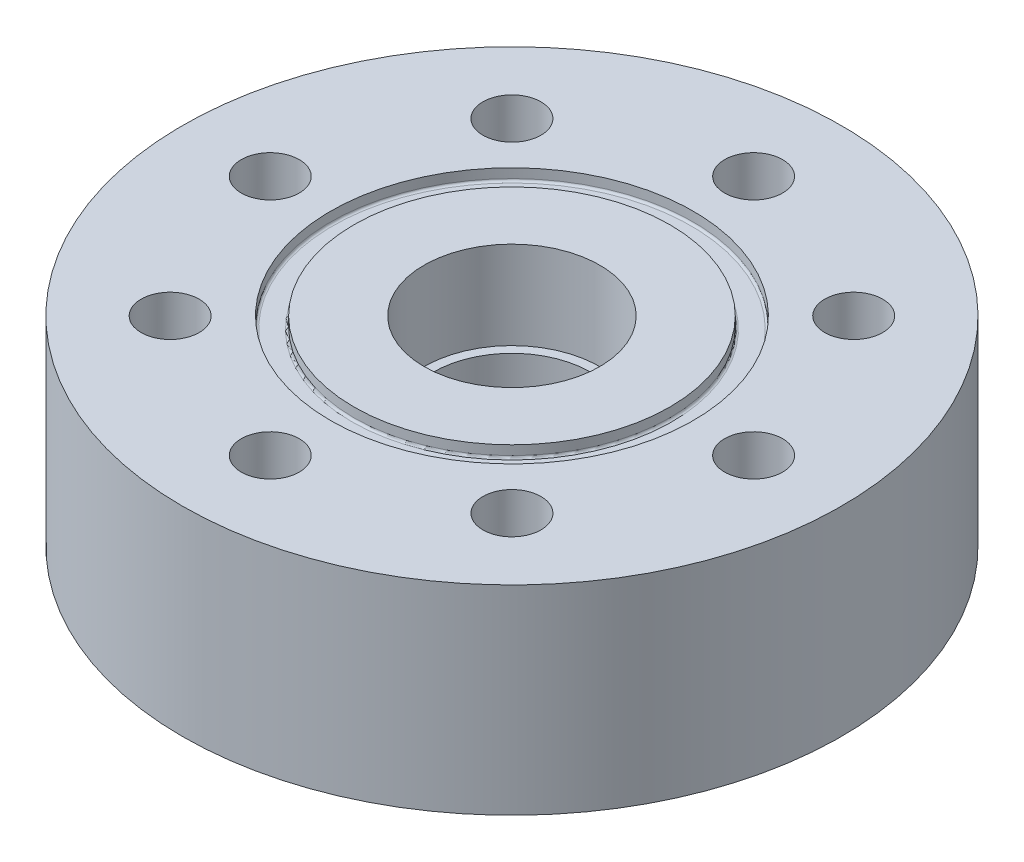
SolidWorks part; units mm, degrees
ref_plane "Front Plane" through (0, 0, 0) normal (0, 0, 1) x (1, 0, 0)
ref_plane "Top Plane" through (0, 0, 0) normal (0, 1, 0) x (1, 0, 0)
ref_plane "Right Plane" through (0, 0, 0) normal (1, 0, 0) x (0, 0, -1)
sketch "Sketch2" plane through (0, 0, 0) normal (0, 1, 0) x (1, 0, 0)
  circle A0 centre (0, 0) radius 37.5
  dimension "D1" = 75
extrude "Outer Cylinder" add sketch "Sketch2" along normal blind 22.7
sketch "Sketch3" plane through (0, 0, 0) normal (0, -1, 0) x (1, 0, 0)
  circle A0 centre (0, 0) radius 8.93
  dimension "D1" = 17.86
extrude "NPT Hole" cut sketch "Sketch3" against normal blind 12.7
sketch "Sketch4" plane through (0, 0, 0) normal (0, -1, 0) x (1, 0, 0)
  circle A0 centre (-27.5, 0) radius 3.3
  circle A1 centre (-19.4454, 19.4454) radius 3.3
  circle A2 centre (0, 27.5) radius 3.3
  circle A3 centre (19.4454, 19.4454) radius 3.3
  circle A4 centre (27.5, 0) radius 3.3
  circle A5 centre (19.4454, -19.4454) radius 3.3
  circle A6 centre (0, -27.5) radius 3.3
  circle A7 centre (-19.4454, -19.4454) radius 3.3
  point P19 (0, 0)
  dimension "D1" = 6.6
  dimension "D2" = 27.5
  dimension "D3" = 8
extrude "Bolt Holes" cut sketch "Sketch4" against normal through all
sketch "Sketch5" plane through (0, 22.7, 0) normal (0, 1, 0) x (1, 0, 0)
  circle A0 centre (0, 0) radius 17.9705
  circle A1 centre (0, 0) radius 20.6375
  dimension "D1" = 41.275
  dimension "D2" = 2.667
extrude "O-Ring Groove" cut sketch "Sketch5" against normal blind 1.3208
fillet "Fillet1" radius 0.254 2 edges at (0, 21.3792, 17.9705) (0, 21.3792, 20.6375)
sketch "Sketch6" plane through (0, 22.7, 0) normal (0, 1, 0) x (1, 0, 0)
  circle A0 centre (0, 0) radius 10
  dimension "D1" = 20
extrude "Inlet Flow Diameter" cut sketch "Sketch6" against normal blind 10
equation "\"D\"= 20"
equation "\"Inlet Flow Diameter\"= \"D\""
